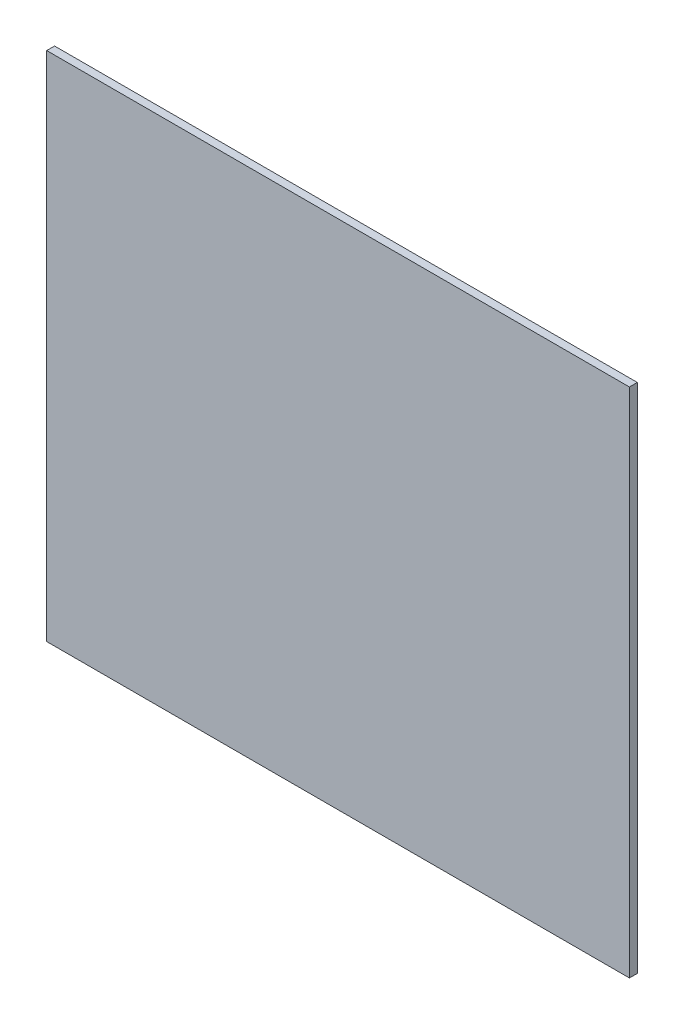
SolidWorks part; units mm, degrees
ref_plane "Front Plane" through (0, 0, 0) normal (0, 0, 1) x (1, 0, 0)
ref_plane "Top Plane" through (0, 0, 0) normal (0, 1, 0) x (1, 0, 0)
ref_plane "Right Plane" through (0, 0, 0) normal (1, 0, 0) x (0, 0, -1)
sketch "Sketch1" plane through (0, 0, 0) normal (0, 0, 1) x (1, 0, 0)
  line L1 (-469.9, -412.75) -> (469.9, -412.75)
  line L2 (-469.9, -412.75) -> (-469.9, 412.75)
  line L3 (-469.9, 412.75) -> (469.9, 412.75)
  line L4 (469.9, -412.75) -> (469.9, 412.75)
  line L5 (-469.9, -412.75) -> (469.9, 412.75) construction
  line L6 (-469.9, 412.75) -> (469.9, -412.75) construction
  point P0 (0, 0)
  dimension "D1" = 939.8
  dimension "D2" = 825.5
extrude "Extrude1" add sketch "Sketch1" along normal mid plane 12.7
